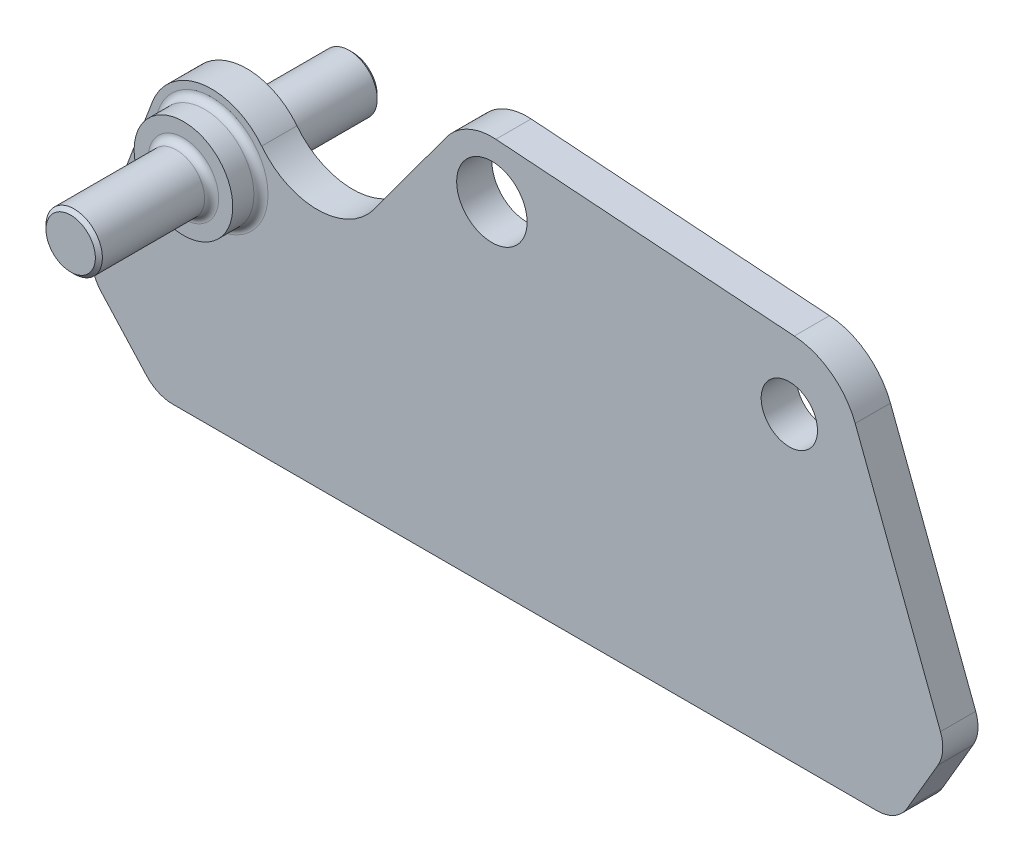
SolidWorks part; units mm, degrees
ref_plane "Face" through (0, 0, 0) normal (0, 0, 1) x (1, 0, 0)
ref_plane "Dessus" through (0, 0, 0) normal (0, 1, 0) x (1, 0, 0)
ref_plane "Droite" through (0, 0, 0) normal (1, 0, 0) x (0, 0, -1)
sketch "Esquisse1" plane through (0, 0, 0) normal (0, 0, 1) x (1, 0, 0)
  line L0 (-47.5, -47.5) -> (57.5, -47.5)
  line L1 (-47.5, -47.5) -> (-57.5, -36.5)
  line L2 (-57.5, -36.5) -> (-48.1851, -11.8218)
  line L3 (57.5, -47.5) -> (64.5, -35.5)
  line L4 (-6.4522, 4.7296) -> (-16.6997, -9.2501)
  line L5 (0.5663, 7.9799) -> (42.9127, 4.9749)
  line L6 (64.5, -35.5) -> (51.552, -1.446)
  circle A0 centre (0, 0) radius 5
  circle A2 centre (42.2049, -5) radius 4
  arc A3 (-32.6597, -9.4759) -> (-48.1851, -11.8218) centre (-39.7649, -15) ccw
  arc A4 (0.5663, 7.9799) -> (-6.4522, 4.7296) centre (0, 0) ccw
  arc A5 (-32.6597, -9.4759) -> (-16.6997, -9.2501) centre (-24.7649, -3.3381) ccw
  arc A6 (51.552, -1.446) -> (42.9127, 4.9749) centre (42.2049, -5) ccw
  dimension "D1" = 10
  dimension "D4" = 8
  dimension "D10" = 11
  dimension "D12" = 18
  dimension "D13" = 16
  dimension "D14" = 20
  dimension "D15" = 10
  dimension "D2" = 42.5
  dimension "D3" = 42.5
  dimension "D6" = 47.5
  dimension "D7" = 42.5
  dimension "D8" = 32.5
  dimension "D9" = 47.5
  dimension "D11" = 10
  dimension "D16" = 15
  dimension "D17" = 105
  dimension "D18" = 7
  dimension "D19" = 12
extrude "Base-Extrusion" add sketch "Esquisse1" along normal blind 5
sketch "Esquisse2" plane through (0, 0, 5) normal (0, 0, 1) x (1, 0, 0)
  circle A0 centre (-39.7649, -15) radius 7
  dimension "D1" = 14
extrude "Boss.-Extru.1" add sketch "Esquisse2" along normal blind 4
sketch "Esquisse3" plane through (0, 0, 9) normal (0, 0, 1) x (1, 0, 0)
  circle A0 centre (-39.7649, -15) radius 4
  dimension "D1" = 8
extrude "Boss.-Extru.2" add sketch "Esquisse3" along normal blind 16
chamfer "Chanfrein1" distance 0.5 angle 45
sketch "Esquisse4" plane through (0, 0, 0) normal (0, 0, -1) x (-1, 0, 0)
  circle A0 centre (39.7649, -15) radius 4
  dimension "D1" = 8
extrude "Boss.-Extru.3" add sketch "Esquisse4" along normal blind 15
chamfer "Chanfrein2" distance 0.5 angle 45
fillet "Congé1" radius 1
fillet "Congé2" radius 1
fillet "Congé3" radius 1
fillet "Congé4" radius 5
ref_plane "Plan1" through (0, 0, 0) normal (0.1181, 0.993, 0) x (-0.993, 0.1181, 0)
ref_plane "Plan2" through (0, 0, 0) normal (-0.3531, 0.9356, 0) x (-0.9356, -0.3531, 0)
